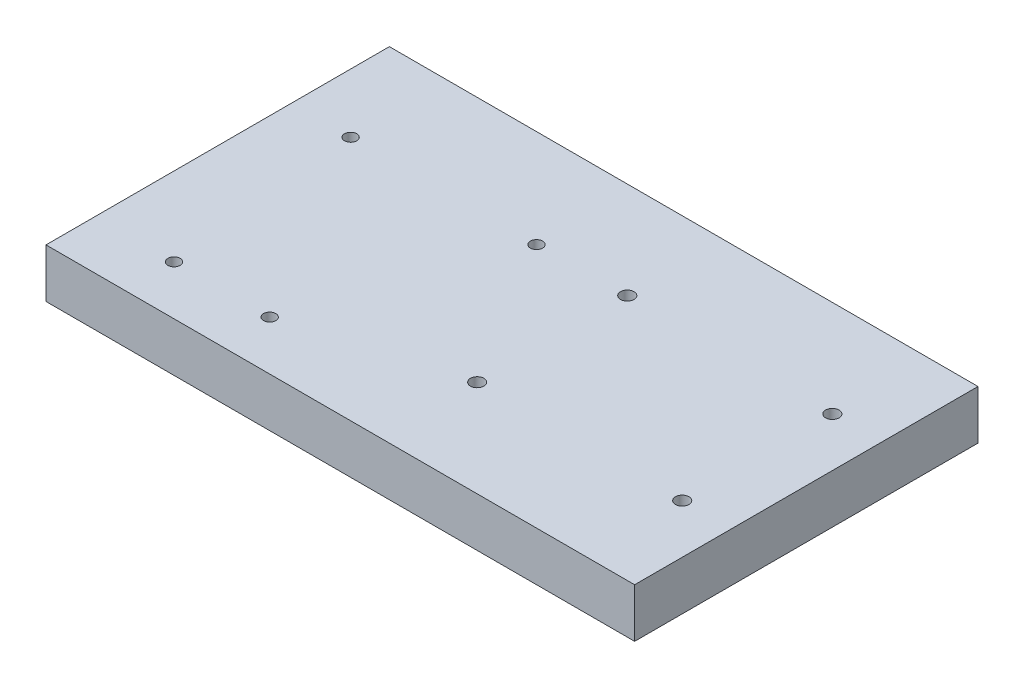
SolidWorks part; units mm, degrees
ref_plane "Front Plane" through (0, 0, 0) normal (0, 0, 1) x (1, 0, 0)
ref_plane "Top Plane" through (0, 0, 0) normal (0, 1, 0) x (1, 0, 0)
ref_plane "Right Plane" through (0, 0, 0) normal (1, 0, 0) x (0, 0, -1)
sketch "Sketch1" plane through (0, 0, 0) normal (0, 1, 0) x (1, 0, 0)
  line L1 (-76.2, -44.45) -> (76.2, -44.45)
  line L2 (-76.2, -44.45) -> (-76.2, 44.45)
  line L3 (-76.2, 44.45) -> (76.2, 44.45)
  line L4 (76.2, -44.45) -> (76.2, 44.45)
  line L5 (-76.2, -44.45) -> (76.2, 44.45) construction
  line L6 (-76.2, 44.45) -> (76.2, -44.45) construction
  point P0 (0, 0)
  dimension "D1" = 152.4
  dimension "D2" = 88.9
extrude "Boss-Extrude1" add sketch "Sketch1" along normal blind 12.7
sketch "Sketch2" plane through (0, 12.7, 0) normal (0, 1, 0) x (1, 0, 0)
  line L0 (-76.2, 0) -> (76.2, 0) construction
  line L1 (-76.2, 44.45) -> (-76.2, -44.45) construction
  line L2 (76.2, -44.45) -> (76.2, 44.45) construction
  line L3 (63.5, 44.45) -> (63.5, -44.45) construction
  line L4 (76.2, 44.45) -> (-76.2, 44.45) construction
  line L5 (-76.2, -44.45) -> (76.2, -44.45) construction
  line L6 (10.414, 44.45) -> (10.414, -44.45) construction
  point P12 (63.5, 19.431)
  point P13 (63.5, -19.431)
  dimension "D1" = 19.431
  dimension "D2" = 19.431
  dimension "D3" = 53.086
  dimension "D4" = 12.7
hole_wizard "#6-32 Tapped Hole1" positions "3DSketch1" profile "Sketch3" tap size "#6-32" standard "ANSI Inch"
sketch3d "3DSketch1"
  line L0 (10.414, 12.7, -44.45) -> (10.414, 12.7, 44.45) construction
  point P0 (63.5, 12.7, -19.431)
  point P3 (63.5, 12.7, 19.431)
  point P7 (10.414, 12.7, -19.431)
  point P11 (10.414, 12.7, 19.431)
sketch "Sketch3" plane through (63.5, 12.7, -19.431) normal (1, 0, 0) x (0, 0, 1)
  line L0 (0, 0) -> (0, 12.7)
  line L1 (0, 12.7) -> (1.7526, 12.7)
  line L2 (1.7526, 12.7) -> (1.7526, 0)
  line L5 (1.7526, 0) -> (0, 0)
  line L11 (0, -6.35) -> (0, 107.95) construction
  dimension "Thread Major Dia." = 3.5052
  dimension "Thru Tap Drill Depth" = 12.7
sketch "Sketch4" plane through (0, 12.7, 0) normal (0, 1, 0) x (1, 0, 0)
  line L0 (-76.2, 44.45) -> (-76.2, -44.45) construction
  line L1 (-63.5, 34.29) -> (-10.16, 34.29) construction
  line L2 (-63.5, 34.29) -> (-63.5, -34.29) construction
  line L3 (-63.5, -34.29) -> (-10.16, -34.29) construction
  line L4 (-10.16, 34.29) -> (-10.16, -34.29) construction
  line L5 (-10.16, 0) -> (-63.5, 0) construction
  line L6 (-36.83, 34.29) -> (-36.83, -34.29) construction
  circle A0 centre (-12.7635, 19.1135) radius 1.5875
  circle A1 centre (-60.8965, 19.1135) radius 1.5875
  circle A2 centre (-17.8435, -31.6865) radius 1.5875 construction
  circle A3 centre (-42.6085, -31.6865) radius 1.5875 construction
  circle A4 centre (-31.0515, -31.6865) radius 1.5875
  circle A5 centre (-55.8165, -31.6865) radius 1.5875
  point P4 (-76.2, 0)
  dimension "D4" = 3.175
  dimension "D5" = 3.175
  dimension "D6" = 15.1765
  dimension "D7" = 2.6035
  dimension "D8" = 2.6035
  dimension "D9" = 2.6035
  dimension "D10" = 3.175
  dimension "D11" = 3.175
  dimension "D1" = 53.34
  dimension "D2" = 68.58
  dimension "D3" = 12.7
  dimension "D12" = 7.6835
  dimension "D13" = 24.765
extrude "Cut-Extrude1" cut sketch "Sketch4" against normal through all
